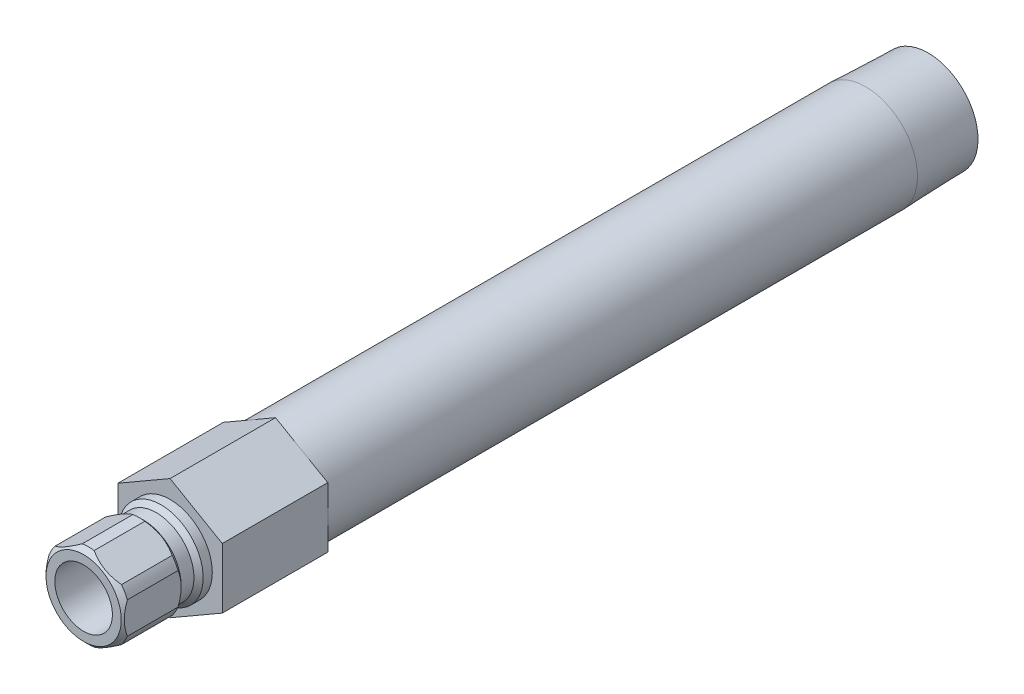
SolidWorks part; units mm, degrees
ref_plane "Front Plane" through (0, 0, 0) normal (0, 0, 1) x (1, 0, 0)
ref_plane "Top Plane" through (0, 0, 0) normal (0, 1, 0) x (1, 0, 0)
ref_plane "Right Plane" through (0, 0, 0) normal (1, 0, 0) x (0, 0, -1)
sketch "Sketch1" plane through (0, 0, 0) normal (1, 0, 0) x (0, 0, -1)
  line L0 (0, 0) -> (-17.4752, 0) construction
  line L1 (-14.3002, 4.7625) -> (-14.3002, 6.223)
  line L2 (-4.3942, 6.223) -> (-4.3942, 0) construction
  line L3 (-13.5382, 6.985) -> (-5.1562, 6.985)
  line L5 (-4.3942, 6.223) -> (-2.2708, 6.223)
  line L6 (-1.5088, 6.985) -> (3.175, 6.985)
  line L7 (3.175, 6.985) -> (3.175, 8.5725)
  line L8 (-4.3942, 6.223) -> (-5.1562, 6.985)
  line L9 (-2.2708, 6.223) -> (-1.5088, 6.985)
  line L10 (-14.3002, 6.223) -> (-13.5382, 6.985)
  line L11 (-14.3002, 4.7625) -> (17.4498, 4.7625)
  line L12 (3.175, 8.5725) -> (115.062, 8.5725)
  line L13 (115.062, 8.5725) -> (125.3998, 8.2494)
  line L14 (125.3998, 8.2494) -> (125.3998, 6.2611)
  line L15 (0, 8.5725) -> (0, 0) construction
  line L16 (17.4498, 4.7625) -> (17.4498, 0) construction
  line L17 (17.4498, 0) -> (0, 0) construction
  line L18 (17.4498, 4.7625) -> (17.4498, 6.2611)
  line L19 (17.4498, 6.2611) -> (125.3998, 6.2611)
  dimension "D1" = 17.4752
  dimension "D2" = 2.1234
  dimension "D3" = 0.762
  dimension "D4" = 45
  dimension "D5" = 9.906
  dimension "D6" = 45
  dimension "D7" = 1.79
  dimension "D8" = 10.3378
  dimension "D9" = 139.7
  dimension "D10" = 3.175
  dimension "D11" = 9.525
  dimension "D12" = 17.145
  dimension "D13" = 31.75
  dimension "D14" = 13.97
  dimension "D15" = 12.5222
  dimension "D16" = 17.4498
revolve "Revolve1" add sketch "Sketch1" angle 360 about L0
sketch "Sketch2" plane through (0, 0, 0) normal (0, 0, 1) x (1, 0, 0)
  line L1 (-8.636, 4.986) -> (-8.636, -4.986)
  line L2 (-8.636, -4.986) -> (0, -9.972)
  line L3 (0, -9.972) -> (8.636, -4.986)
  line L4 (8.636, -4.986) -> (8.636, 4.986)
  line L5 (8.636, 4.986) -> (0, 9.972)
  line L6 (0, 9.972) -> (-8.636, 4.986)
  circle A0 centre (0, 0) radius 8.636 construction
  circle A1 centre (0, 0) radius 4.7625 construction
  circle A2 centre (0, 0) radius 4.7625
  dimension "D1" = 17.272
extrude "Boss-Extrude1" add sketch "Sketch2" against normal up to vertex (17.4498 mm away)
sketch "Sketch3" plane through (0, 0, 0) normal (0, 0, 1) x (1, 0, 0)
  line L1 (6.477, -3.7395) -> (6.477, 3.7395)
  line L2 (6.477, 3.7395) -> (0, 7.479)
  line L3 (0, 7.479) -> (-6.477, 3.7395)
  line L4 (-6.477, 3.7395) -> (-6.477, -3.7395)
  line L5 (-6.477, -3.7395) -> (0, -7.479)
  line L6 (0, -7.479) -> (6.477, -3.7395)
  circle A0 centre (0, 0) radius 6.477 construction
  dimension "D1" = 12.954
extrude "Cut-Extrude1" cut sketch "Sketch3" along normal through all from vertex at 4.3942 flip side to cut
